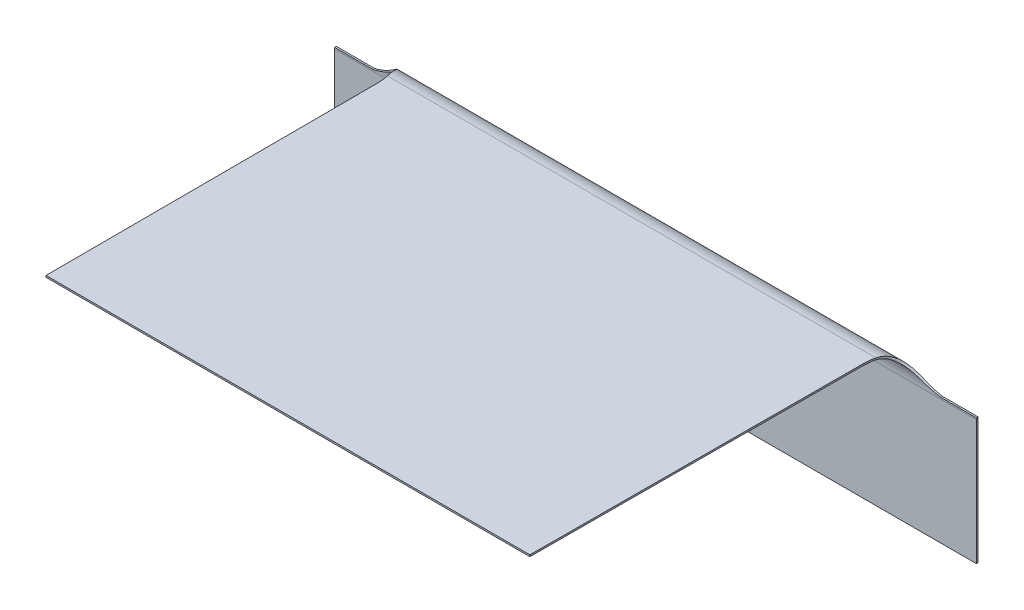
SolidWorks part; units mm, degrees
ref_plane "Front Plane" through (0, 0, 0) normal (0, 0, 1) x (1, 0, 0)
ref_plane "Top Plane" through (0, 0, 0) normal (0, 1, 0) x (1, 0, 0)
ref_plane "Right Plane" through (0, 0, 0) normal (1, 0, 0) x (0, 0, -1)
sketch "Sketch2" plane through (0, 0, 0) normal (1, 0, 0) x (0, 0, -1)
  line L0 (-7.1206, 0) -> (162.0688, 0)
  line L1 (174.7688, -12.7) -> (174.7688, -74.3966)
  line L2 (174.7688, -74.3966) -> (175.5816, -74.3966)
  line L3 (175.5816, -74.3966) -> (175.5816, -11.8872)
  line L4 (162.8816, 0.8128) -> (-7.1206, 0.8128)
  line L5 (-7.1206, 0.8128) -> (-7.1206, 0)
  arc A0 (175.5816, -11.8872) -> (162.8816, 0.8128) centre (162.8816, -11.8872) ccw
  arc A1 (174.7688, -12.7) -> (162.0688, 0) centre (162.0688, -12.7) ccw
  point P9 (175.5816, 0.8128)
  dimension "D5" = 12.7
  dimension "D1" = 0.8128
  dimension "D2" = 0.8128
  dimension "D3" = 182.7022
  dimension "D4" = 75.2094
extrude "Boss-Extrude2" add sketch "Sketch2" along normal blind 317.5
sketch "Sketch4" plane through (0, 0.8128, 0) normal (0, 1, 0) x (1, 0, 0)
  line L0 (158.75, -7.1206) -> (158.75, 175.5816) construction
  line L1 (317.5, -7.1206) -> (0, -7.1206) construction
  line L2 (317.5, 175.5816) -> (0, 175.5816) construction
  line L3 (278.765, -7.1206) -> (278.765, 157.4206)
  line L8 (0, -7.1206) -> (38.735, -7.1206)
  line L10 (-13.8363, 182.8206) -> (13.335, 182.8206)
  line L11 (38.735, -7.1206) -> (38.735, 157.4206)
  line L12 (337.7651, 182.8206) -> (304.165, 182.8206)
  line L14 (317.5, -7.1206) -> (278.765, -7.1206)
  line L15 (-13.8363, 182.8206) -> (0, -7.1206)
  line L16 (337.7651, 182.8206) -> (317.5, -7.1206)
  arc A0 (38.735, 157.4206) -> (13.335, 182.8206) centre (13.335, 157.4206) ccw
  arc A1 (278.765, 157.4206) -> (304.165, 182.8206) centre (304.165, 157.4206) cw
  dimension "D3" = 25.4
  dimension "D2" = 120.015
wrap "Wrap1" sketch "Sketch4" wrap type deboss source sketch "Sketch4" thickness 2.54 parameters "D1"=2.54
